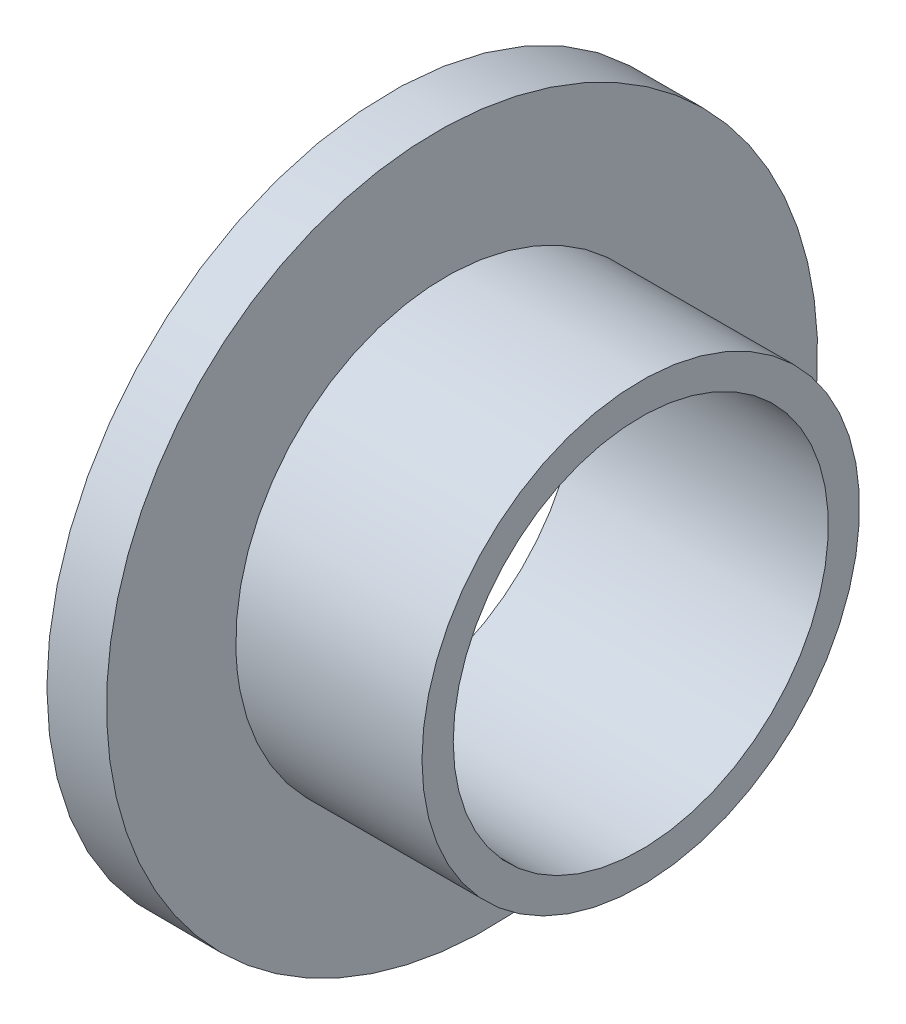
SolidWorks part; units mm, degrees
ref_plane "Plan de face" through (0, 0, 0) normal (0, 0, 1) x (1, 0, 0)
ref_plane "Plan de dessus" through (0, 0, 0) normal (0, 1, 0) x (1, 0, 0)
ref_plane "Plan de droite" through (0, 0, 0) normal (1, 0, 0) x (0, 0, -1)
sketch "Esquisse2" plane through (0, 0, 0) normal (0, 0, 1) x (1, 0, 0)
  line L0 (-23.3664, 0) -> (0.5599, 0) construction
  line L1 (16, 6) -> (-16, 6) construction
  line L3 (-17.0091, 7) -> (-11.0091, 7)
  line L4 (-17.0091, 7) -> (-17.0091, 6)
  line L5 (-17.0091, 6) -> (-11.0091, 6)
  line L6 (-11.0091, 7) -> (-11.0091, 6)
  dimension "D1" = 6
revolve "Révolution1" add sketch "Esquisse2" angle 360 about L0
ref_plane "Plan1" through (-19.0091, 0, 0) normal (-1, 0, 0) x (0, 0, 1)
sketch "Esquisse4" plane through (-19.0091, 0, 0) normal (-1, 0, 0) x (0, 0, 1)
  circle A0 centre (0, 0) radius 11
  dimension "D1" = 22
extrude "Extrusion1" add sketch "Esquisse4" along normal up to surface (1.9182 mm away)
sketch "Esquisse5" plane through (-11.0091, 0, 0) normal (-1, 0, 0) x (0, 0, 1)
  circle A0 centre (0, 0) radius 6
  arc A1 (1.4266, 5.8279) -> (5.4403, 2.5304) centre (0, 0) ccw construction
extrude "Enlèv. mat.-Extru.1" cut sketch "Esquisse5" along normal through all
sketch "Esquisse6" plane through (-11.0091, 0, 0) normal (1, 0, 0) x (0, 0, -1)
  circle A0 centre (0, 0) radius 6 construction
  circle A1 centre (0, 0) radius 7
  circle A2 centre (0, 0) radius 7
  circle A3 centre (0, 0) radius 6
  dimension "D1" = 0
extrude "Extrusion2" add sketch "Esquisse6" against normal up to body
